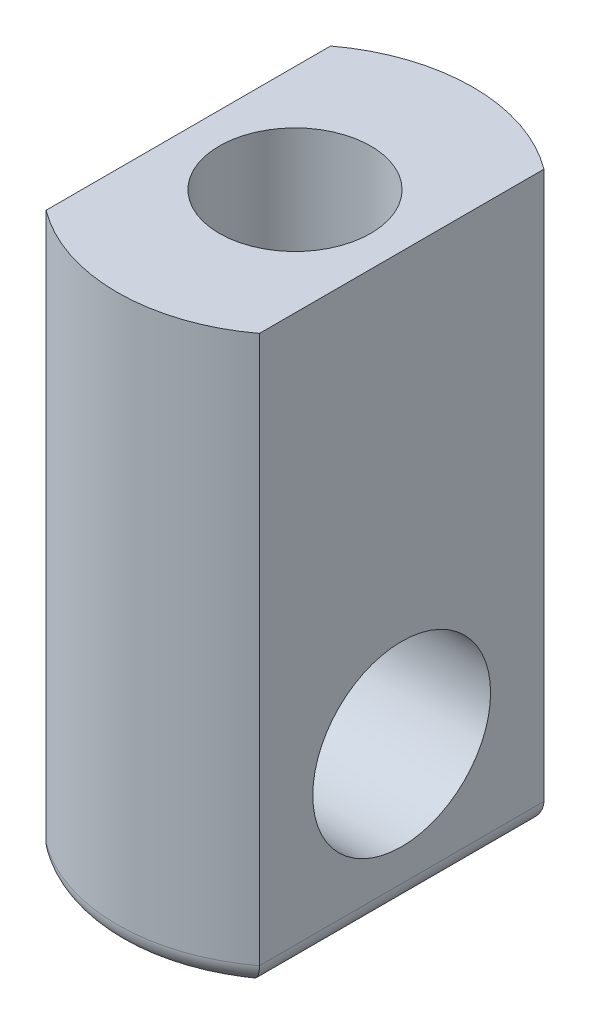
SolidWorks part; units mm, degrees
ref_plane "Front Plane" through (0, 0, 0) normal (0, 0, 1) x (1, 0, 0)
ref_plane "Top Plane" through (0, 0, 0) normal (0, 1, 0) x (1, 0, 0)
ref_plane "Right Plane" through (0, 0, 0) normal (1, 0, 0) x (0, 0, -1)
sketch "Sketch1" plane through (0, 0, 0) normal (0, 1, 0) x (1, 0, 0)
  circle A0 centre (0, 0) radius 3.175
  dimension "D1" = 6.35
extrude "rod" add sketch "Sketch1" along normal blind 10.16
sketch "Sketch2" plane through (0, 0, 0) normal (0, -1, 0) x (1, 0, 0)
  line L2 (-1.905, 2.54) -> (-1.905, -2.54)
  line L4 (1.905, 2.54) -> (1.905, -2.54)
  circle A0 centre (0, 0) radius 3.175 construction
  arc A1 (-1.905, 2.54) -> (-1.905, -2.54) centre (0, 0) ccw
  arc A2 (1.905, -2.54) -> (1.905, 2.54) centre (0, 0) ccw
  dimension "D1" = 3.81
  dimension "D2" = 1.905
extrude "Cut-Extrude1" cut sketch "Sketch2" against normal blind 10.16
sketch "Sketch3" plane through (1.905, 0, 0) normal (1, 0, 0) x (0, 0, -1)
  line L0 (0, 0) -> (0, 7.2084) construction
  line L1 (-2.54, 0) -> (2.54, 0) construction
  circle A0 centre (0, 2.54) radius 1.5875
  dimension "D1" = 3.175
  dimension "D2" = 2.54
extrude "Cut-Extrude2" cut sketch "Sketch3" against normal through all
hole_wizard "#6-32 Tapped Hole1" positions "Sketch4" profile "Sketch5" tap size "#6-32" standard "ANSI Inch"
sketch "Sketch4" plane through (0, 10.16, 0) normal (0, 1, 0) x (1, 0, 0)
  point P0 (0, 0)
sketch "Sketch5" plane through (0, 10.16, 0) normal (1, 0, 0) x (0, 0, 1)
  line L0 (0, 0) -> (0, 7.6707)
  line L1 (0, 7.6707) -> (1.3525, 6.858)
  line L2 (1.3525, 6.858) -> (1.3525, 0)
  line L5 (1.3525, 0) -> (0, 0)
  line L10 (0, 7.6707) -> (-1.3526, 6.858) construction
  line L11 (0, -6.35) -> (0, 107.95) construction
  dimension "Tap Drill Dia." = 2.7051
  dimension "Tap Drill Depth" = 6.858
  dimension "Drill Angle" = 118
fillet "Fillet1" radius 0.381 4 edges at (1.905, 0, 0) (0, 0, 3.175) (0, 0, -3.175) (-1.905, 0, 0)
